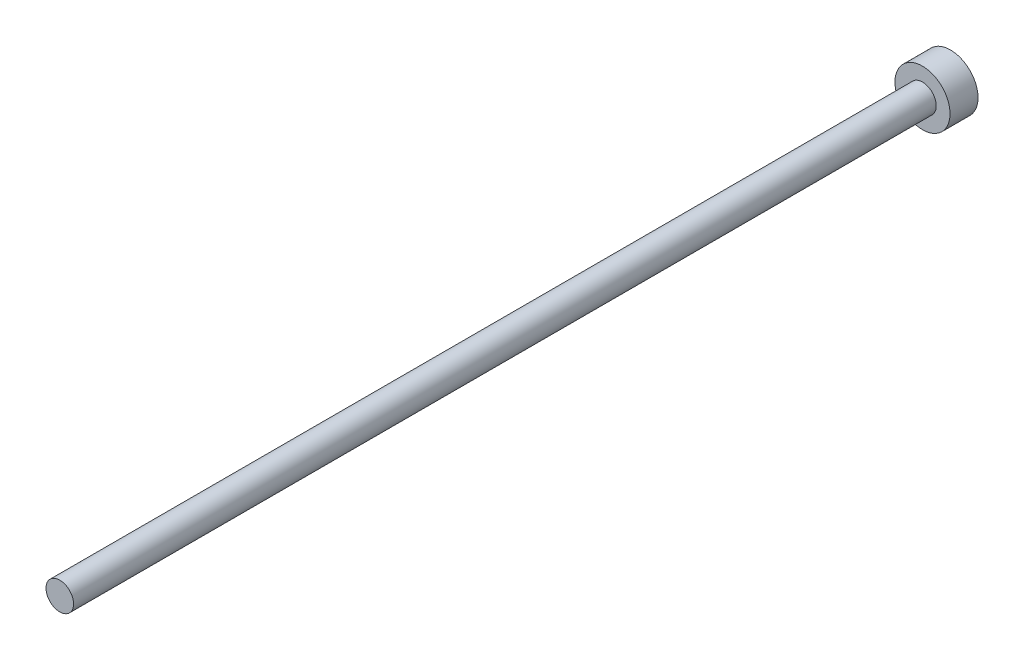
SolidWorks part; units mm, degrees
ref_plane "Plan de face" through (0, 0, 0) normal (0, 0, 1) x (1, 0, 0)
ref_plane "Plan de dessus" through (0, 0, 0) normal (0, 1, 0) x (1, 0, 0)
ref_plane "Plan de droite" through (0, 0, 0) normal (1, 0, 0) x (0, 0, -1)
sketch "Esquisse1" plane through (0, 0, 0) normal (0, 0, 1) x (1, 0, 0)
  circle A0 centre (0, 0) radius 1.5
  dimension "D1" = 3
extrude "Extrusion1" add sketch "Esquisse1" along normal blind 93.95
sketch "Esquisse2" plane through (0, 0, 0) normal (0, 0, -1) x (-1, 0, 0)
  circle A0 centre (0, 0) radius 3
  dimension "D1" = 6
extrude "Extrusion2" add sketch "Esquisse2" along normal blind 3.05
